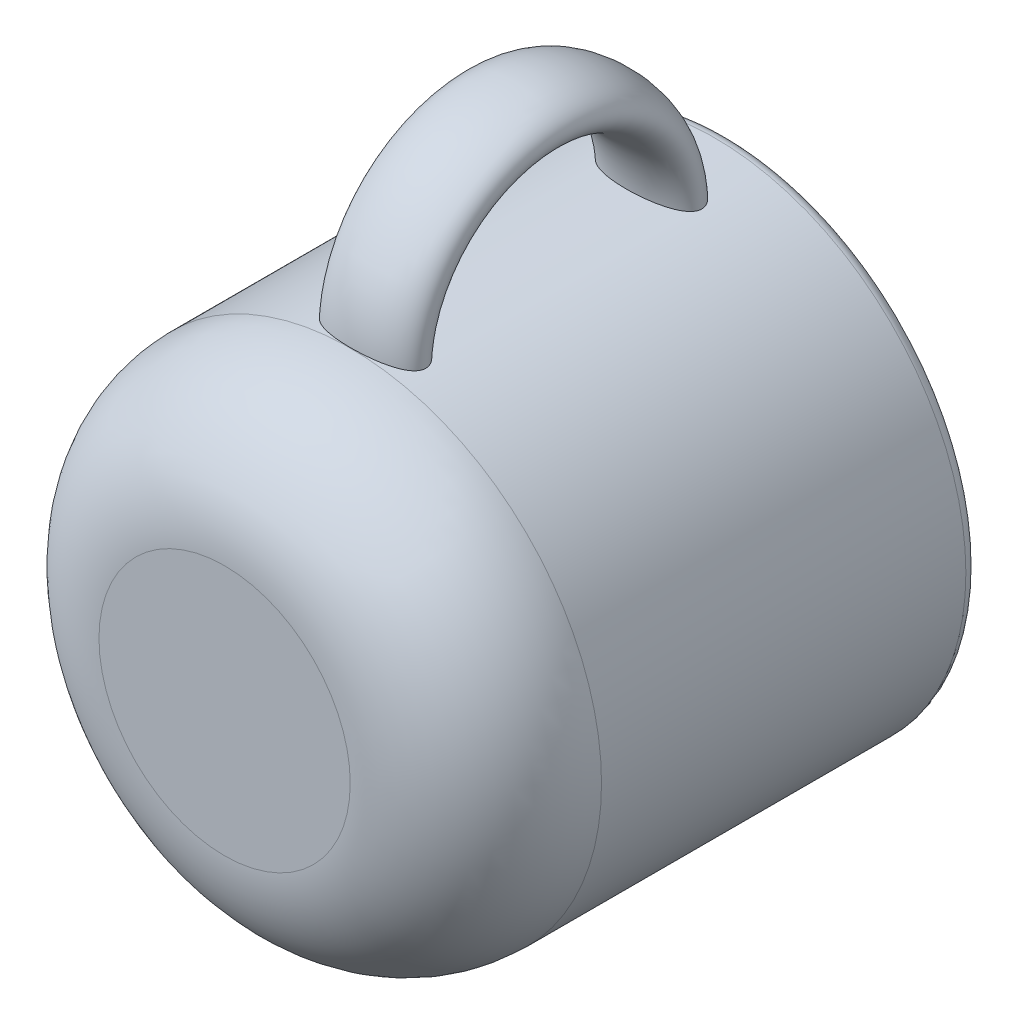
SolidWorks part; units mm, degrees
ref_plane "Plane1" through (0, 0, 0) normal (0, 0, 1) x (1, 0, 0)
ref_plane "Plan2" through (0, 0, 0) normal (0, 1, 0) x (1, 0, 0)
ref_plane "Plane3" through (0, 0, 0) normal (1, 0, 0) x (0, 0, -1)
sketch "Sketch1" plane through (0, 0, 0) normal (0, 0, 1) x (1, 0, 0)
  circle A0 centre (0, 0) radius 100
extrude "Base-Extrude" add sketch "Sketch1" along normal blind 200
fillet "Fillet1" radius 50 1 edges at (100, 0, 200)
shell "Shell1" thickness 10
ref_plane "Plane4" through (0, 0, 0) normal (0, 1, 0) x (1, 0, 0)
ref_plane "Plane5" through (0, 95, 0) normal (0, 1, 0) x (-1, 0, 0)
sketch "Sketch2" plane through (0, 95, 0) normal (0, 1, 0) x (-1, 0, 0)
  line L1 (0, 150) -> (0, 0) construction
  ellipse E0 centre (0, 30) end of major axis (20, 30) minor radius 10
sketch "Sketch3" plane through (0, 0, 0) normal (1, 0, 0) x (0, 0, -1)
  line L0 (127.6171, 95) -> (-127.6171, 95) construction
  arc A0 (-30, 95) -> (-139.9993, 95) centre (-84.9996, 95.1971) ccw
  dimension "D1" = 55
sweep "Boss-Sweep1" add profiles "Sketch2" path "Sketch3"
fillet "Fillet2" radius 5 2 edges at (100, 0, 0) (90, 0, 0)
